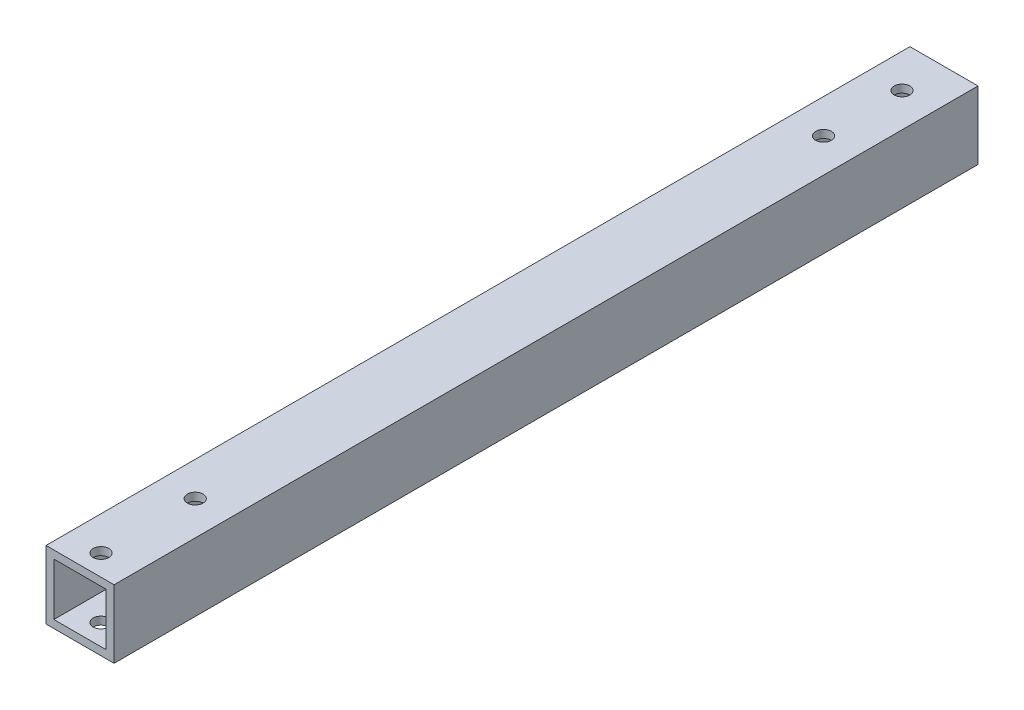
SolidWorks part; units mm, degrees
ref_plane "Спереди" through (0, 0, 0) normal (0, 0, 1) x (1, 0, 0)
ref_plane "Сверху" through (0, 0, 0) normal (0, 1, 0) x (1, 0, 0)
ref_plane "Справа" through (0, 0, 0) normal (1, 0, 0) x (0, 0, -1)
sketch "Эскиз1" plane through (0, 0, 0) normal (0, 0, 1) x (1, 0, 0)
  line L1 (-6.5, 6.5) -> (6.5, 6.5)
  line L2 (-6.5, 6.5) -> (-6.5, -6.5)
  line L3 (-6.5, -6.5) -> (6.5, -6.5)
  line L4 (6.5, 6.5) -> (6.5, -6.5)
  line L5 (-6.5, 6.5) -> (6.5, -6.5) construction
  line L6 (-6.5, -6.5) -> (6.5, 6.5) construction
  point P0 (0, 0)
  dimension "D1" = 13
  dimension "D2" = 13
extrude "Бобышка-Вытянуть1" add sketch "Эскиз1" along normal blind 165
shell "Оболочка1" thickness 1.5
sketch "Эскиз2" plane through (0, 6.5, 0) normal (0, 1, 0) x (1, 0, 0)
  line L0 (6.5, 0) -> (-6.5, 0) construction
  line L1 (6.5, -165) -> (-6.5, -165) construction
  circle A0 centre (0, -8) radius 1.5
  circle A1 centre (0, -23) radius 1.5
  circle A2 centre (0, -161) radius 1.5
  circle A3 centre (0, -143) radius 1.5
  dimension "D1" = 8
  dimension "D2" = 15
  dimension "D3" = 4
  dimension "D4" = 18
extrude "Вырез-Вытянуть1" cut sketch "Эскиз2" against normal through all
